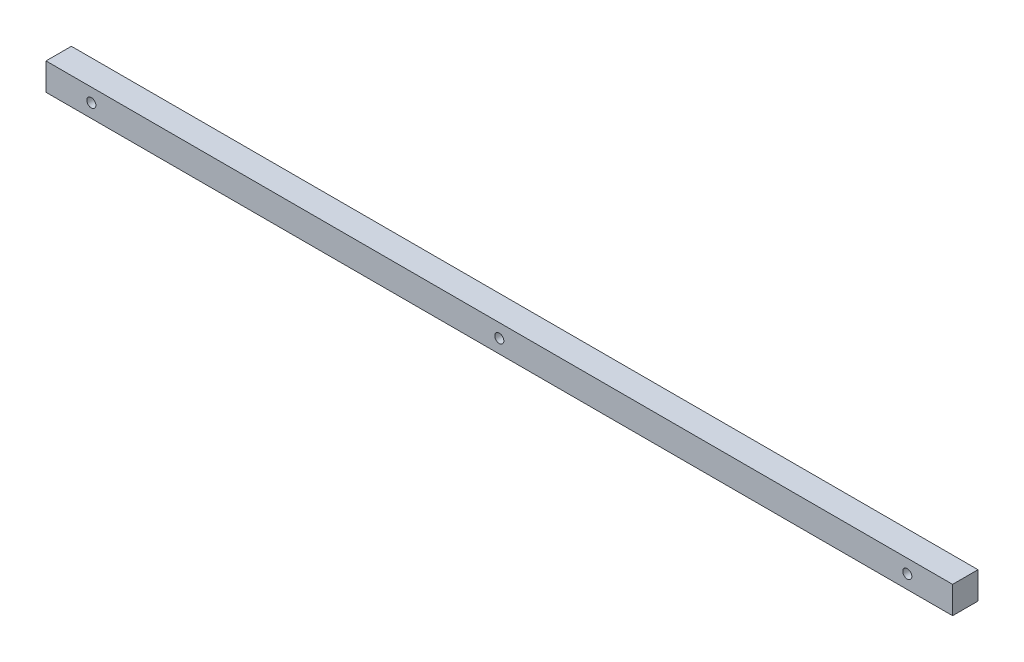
SolidWorks part; units mm, degrees
ref_plane "Спереди" through (0, 0, 0) normal (0, 0, 1) x (1, 0, 0)
ref_plane "Сверху" through (0, 0, 0) normal (0, 1, 0) x (1, 0, 0)
ref_plane "Справа" through (0, 0, 0) normal (1, 0, 0) x (0, 0, -1)
sketch "Эскиз1" plane through (0, 0, 0) normal (0, 0, 1) x (1, 0, 0)
  line L0 (-450, 0) -> (450, 0) construction
  line L1 (-500, 15) -> (500, 15)
  line L2 (-500, 15) -> (-500, -15)
  line L3 (-500, -15) -> (500, -15)
  line L4 (500, 15) -> (500, -15)
  line L5 (0, -15) -> (0, 15) construction
  circle A0 centre (450, 0) radius 5
  circle A1 centre (-450, 0) radius 5
  circle A2 centre (0, 0) radius 5
  dimension "D3" = 10
  dimension "D1" = 30
  dimension "D2" = 1000
  dimension "D4" = 50
extrude "Бобышка-Вытянуть1" add sketch "Эскиз1" along normal blind 28
